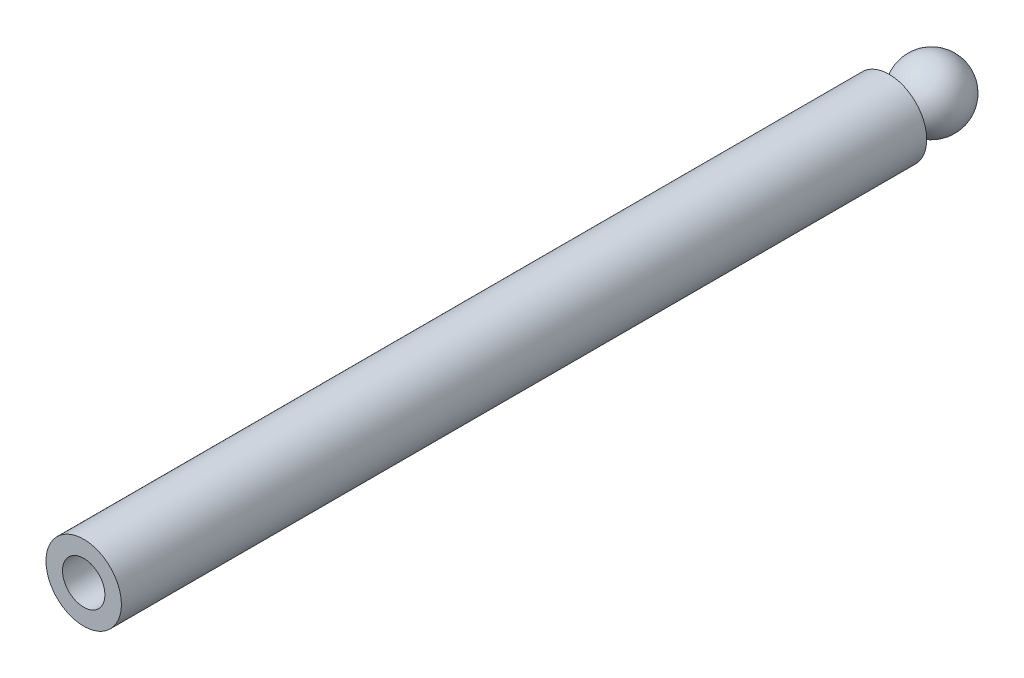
SolidWorks part; units mm, degrees
ref_plane "正面" through (0, 0, 0) normal (0, 0, 1) x (1, 0, 0)
ref_plane "平面" through (0, 0, 0) normal (0, 1, 0) x (1, 0, 0)
ref_plane "右側面" through (0, 0, 0) normal (1, 0, 0) x (0, 0, -1)
sketch "ｽｹｯﾁ1" plane through (0, 0, 0) normal (0, 0, 1) x (1, 0, 0)
  line L0 (0, 75.9872) -> (0, -101.9193) construction
  line L1 (0, 35) -> (0, -35)
  arc A0 (0, 35) -> (0, -35) centre (0, 0) cw
  dimension "D1" = 35
revolve "回転1" add sketch "ｽｹｯﾁ1" angle 360 about L0
sketch "ｽｹｯﾁ2" plane through (0, 0, 0) normal (0, 0, 1) x (1, 0, 0)
  circle A0 centre (0, 0) radius 10
  dimension "D1" = 20
extrude "押し出し1" add sketch "ｽｹｯﾁ2" along normal blind 45
sketch "ｽｹｯﾁ3" plane through (0, 0, 45) normal (0, 0, 1) x (1, 0, 0)
  circle A0 centre (0, 0) radius 40
  dimension "D1" = 80
extrude "押し出し2" add sketch "ｽｹｯﾁ3" along normal blind 855
sketch "ｽｹｯﾁ4" plane through (0, 0, 900) normal (0, 0, 1) x (1, 0, 0)
  circle A0 centre (0, 0) radius 22.5
  dimension "D1" = 45
extrude "押し出し3" cut sketch "ｽｹｯﾁ4" against normal blind 450
